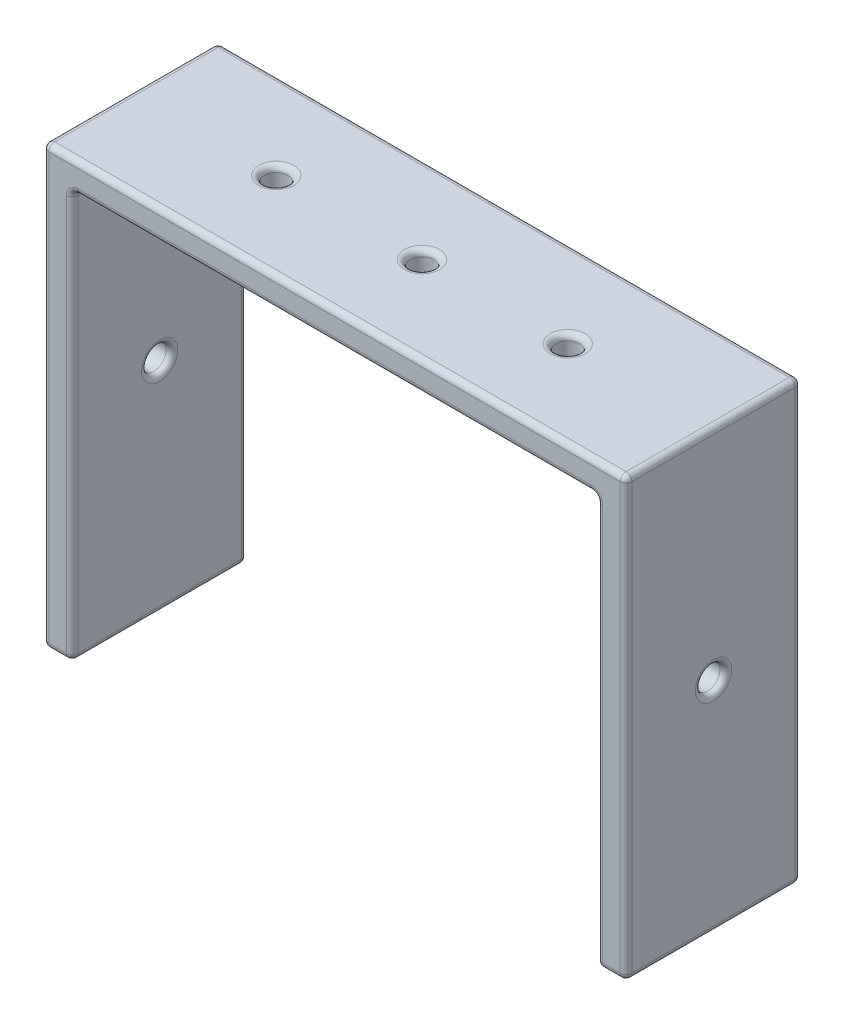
SolidWorks part; units mm, degrees
ref_plane "Front Plane" through (0, 0, 0) normal (0, 0, 1) x (1, 0, 0)
ref_plane "Top Plane" through (0, 0, 0) normal (0, 1, 0) x (1, 0, 0)
ref_plane "Right Plane" through (0, 0, 0) normal (1, 0, 0) x (0, 0, -1)
sketch "Sketch1" plane through (0, 0, 0) normal (0, 0, 1) x (1, 0, 0)
  line L0 (0, -55) -> (0, 55) construction
  line L1 (-100, 110.5449) -> (100, 110.5449)
  line L2 (-100, 110.5449) -> (-100, -39.4551)
  line L3 (-100, -39.4551) -> (-90, -39.4551)
  line L4 (100, 110.5449) -> (100, -39.4551)
  line L5 (-90, 100.5449) -> (-90, -29.4551)
  line L7 (90, 100.5449) -> (90, -29.4551)
  line L8 (-90, 100.5449) -> (90, 100.5449)
  line L9 (-90, -29.4551) -> (-90, -39.4551)
  line L10 (90, -29.4551) -> (90, -39.4551)
  line L11 (90, -39.4551) -> (100, -39.4551)
  line L12 (-90, -29.4551) -> (90, -29.4551) construction
  line L13 (-100, -39.4551) -> (100, -39.4551) construction
  dimension "D1" = 100
  dimension "D2" = 100
  dimension "D3" = 150
  dimension "D4" = 10
extrude "Boss-Extrude1" add sketch "Sketch1" along normal blind 60
sketch "Sketch2" plane through (-100, 0, 0) normal (-1, 0, 0) x (0, 0, 1)
  circle A0 centre (30, 35.5449) radius 4.2
extrude "Cut-Extrude1" cut sketch "Sketch2" against normal blind 210
sketch "Sketch4" plane through (0, 110.5449, 0) normal (0, 1, 0) x (1, 0, 0)
  line L1 (0, -33) -> (0, 33) construction
  circle A0 centre (-50, -30) radius 4
  circle A1 centre (0, -30) radius 4
  circle A2 centre (50, -30) radius 4
extrude "Cut-Extrude2" cut sketch "Sketch4" against normal blind 210
fillet "Fillet1" radius 2 31 edges at (90, 100.5449, 30) (90, -39.4551, 30) (90, 35.5449, 25.8) (-95, -39.4551, 0) (-90, 30.5449, 0) (0, 100.5449, 0) (90, 30.5449, 0) (95, -39.4551, 0) (100, -39.4551, 30) (100, 35.5449, 0) (100, 31.3449, 30) (100, 110.5449, 30) (0, 110.5449, 0) (-50, 110.5449, 34) (0, 110.5449, 34) (50, 110.5449, 34) (0, 110.5449, 60) (100, 35.5449, 60) (95, -39.4551, 60) (90, 30.5449, 60) (0, 100.5449, 60) (-90, 30.5449, 60) (-95, -39.4551, 60) (-100, 110.5449, 30) (-100, 35.5449, 60) (-100, -39.4551, 30) (-100, 35.5449, 0) (-100, 31.3449, 30) (-90, -39.4551, 30) (-90, 100.5449, 30) (-90, 35.5449, 34.2)
